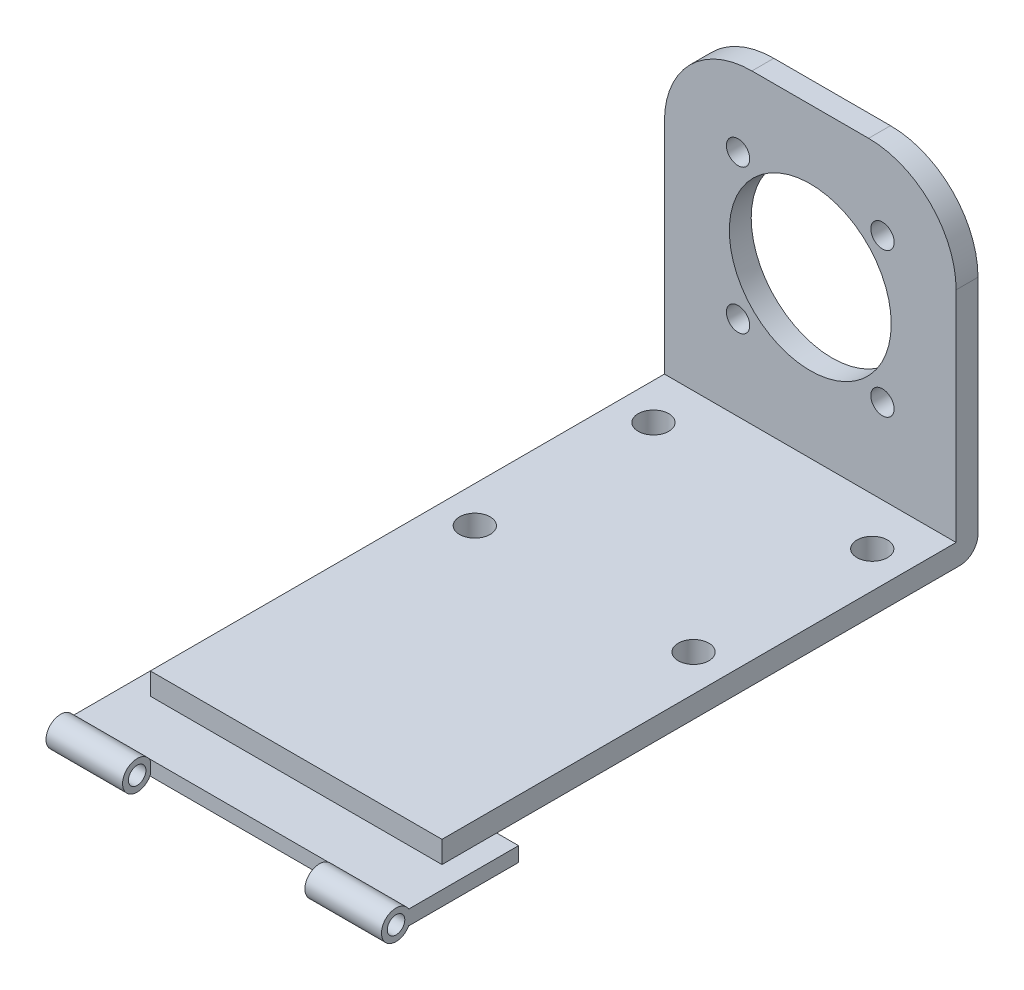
SolidWorks part; units mm, degrees
ref_plane "Front Plane" through (0, 0, 0) normal (0, 0, 1) x (1, 0, 0)
ref_plane "Top Plane" through (0, 0, 0) normal (0, 1, 0) x (1, 0, 0)
ref_plane "Right Plane" through (0, 0, 0) normal (1, 0, 0) x (0, 0, -1)
sketch "Sketch1" plane through (0, 0, 0) normal (1, 0, 0) x (0, 0, -1)
  line L0 (23.1464, 33.4195) -> (23.1464, -8.5805)
  line L1 (23.1464, -8.5805) -> (-15.3536, -8.5805)
  line L2 (-15.3536, -8.5805) -> (-15.3536, -11.5805)
  line L3 (-15.3536, -11.5805) -> (23.6464, -11.5805)
  line L4 (26.1464, -9.0805) -> (26.1464, 33.4195)
  line L5 (26.1464, 33.4195) -> (23.1464, 33.4195)
  arc A0 (23.6464, -11.5805) -> (26.1464, -9.0805) centre (23.6464, -9.0805) ccw
  point P8 (26.1464, -11.5805)
  dimension "D5" = 2.5
  dimension "D1" = 41.5
  dimension "D2" = 45
  dimension "D3" = 3
  dimension "D4" = 3
extrude "Boss-Extrude1" add sketch "Sketch1" against normal blind 40
sketch "Sketch2" plane through (0, 0, -23.1464) normal (0, 0, 1) x (1, 0, 0)
  line L0 (-40, 33.4195) -> (0, 33.4195) construction
  line L1 (-31.1, 12.9195) -> (-8.9, 12.9195)
  circle A1 centre (-20, 12.9195) radius 11.1
  circle A2 centre (-10.1005, 22.819) radius 1.6
  circle A4 centre (-29.8995, 3.02) radius 1.6
  circle A5 centre (-29.8995, 22.819) radius 1.6
  circle A6 centre (-10.1005, 3.02) radius 1.6
  point P0 (-20, 12.9195)
  dimension "D3" = 22.2
  dimension "D4" = 3.2
  dimension "D5" = 3.2
  dimension "D6" = 3.2
  dimension "D7" = 3.2
  dimension "D1" = 20.5
extrude "Cut-Extrude1" cut sketch "Sketch2" against normal blind 40 contours A1 | A4 | A6 | A2 | A5
sketch "Sketch3" plane through (0, 0, -23.1464) normal (0, 0, 1) x (1, 0, 0)
  line L1 (0, 21.4195) -> (0, 33.4195)
  line L3 (0, 33.4195) -> (-12, 33.4195)
  line L5 (-28, 33.4195) -> (-40, 33.4195)
  line L6 (-40, 33.4195) -> (-40, 21.4195)
  arc A0 (-12, 33.4195) -> (0, 21.4195) centre (-12, 21.4195) cw
  arc A1 (-28, 33.4195) -> (-40, 21.4195) centre (-28, 21.4195) ccw
  dimension "D1" = 12
extrude "Cut-Extrude2" cut sketch "Sketch3" against normal blind 40
sketch "Sketch4" plane through (0, -8.5805, 0) normal (0, 1, 0) x (1, 0, 0)
  line L0 (-40, -15.3536) -> (0, -15.3536) construction
  line L1 (-5, -7.8536) -> (-35, -7.8536)
  line L2 (-5, -7.8536) -> (-5, 16.6464)
  line L3 (-5, 16.6464) -> (-35, 16.6464)
  line L4 (-35, -7.8536) -> (-35, 16.6464)
  line L5 (-5, -7.8536) -> (-35, 16.6464) construction
  line L6 (-5, 16.6464) -> (-35, -7.8536) construction
  line L8 (0, 23.1464) -> (0, -15.3536) construction
  circle A0 centre (-5, -7.8536) radius 2.1
  circle A1 centre (-35, -7.8536) radius 2.1
  circle A2 centre (-35, 16.6464) radius 2.1
  circle A3 centre (-5, 16.6464) radius 2.1
  point P0 (-20, 4.3964)
  dimension "D4" = 4.2
  dimension "D5" = 4.2
  dimension "D6" = 4.2
  dimension "D7" = 4.2
  dimension "D1" = 30
  dimension "D2" = 24.5
  dimension "D3" = 7.5
  dimension "D8" = 5
extrude "Cut-Extrude3" cut sketch "Sketch4" against normal blind 40 contours A1 | A2 | A0 | A3
sketch "Sketch5" plane through (-40, 0, 0) normal (-1, 0, 0) x (0, 0, 1)
  line L1 (15.3536, -8.5805) -> (47.3536, -8.5805)
  line L2 (15.3536, -8.5805) -> (15.3536, -11.5805)
  line L3 (15.3536, -11.5805) -> (47.3536, -11.5805)
  line L4 (47.3536, -8.5805) -> (47.3536, -11.5805)
  dimension "D1" = 32
extrude "Boss-Extrude2" add sketch "Sketch5" against normal up to surface (40 mm away)
sketch "Sketch6" plane through (0, -11.5805, 0) normal (0, -1, 0) x (1, 0, 0)
  line L0 (0, 47.3536) -> (-40, 47.3536) construction
  line L1 (-45, 54.8536) -> (5, 54.8536)
  line L2 (-45, 54.8536) -> (-45, 39.8536)
  line L3 (-45, 39.8536) -> (5, 39.8536)
  line L4 (5, 54.8536) -> (5, 39.8536)
  line L5 (-45, 54.8536) -> (5, 39.8536) construction
  line L6 (-45, 39.8536) -> (5, 54.8536) construction
  point P0 (-20, 47.3536)
  dimension "D1" = 50
  dimension "D2" = 15
extrude "Boss-Extrude3" add sketch "Sketch6" along normal blind 2
sketch "Sketch8" plane through (-45, 0, 0) normal (-1, 0, 0) x (0, 0, 1)
  line L0 (54.8536, -13.5805) -> (54.8536, -11.5805) construction
  circle A0 centre (56.6536, -12.5805) radius 2
  circle A1 centre (56.6536, -12.5805) radius 1.2
  dimension "D1" = 4
  dimension "D3" = 2.4
  dimension "D2" = 1.8
extrude "Boss-Extrude4" add sketch "Sketch8" along normal blind 12.5 and the other way blind 12.5
sketch "Sketch9" plane through (5, 0, 0) normal (1, 0, 0) x (0, 0, -1)
  circle A1 centre (-56.6536, -12.5805) radius 1.2
  circle A2 centre (-56.6536, -12.5805) radius 1.2
  circle A3 centre (-56.6536, -12.5805) radius 2
  circle A4 centre (-56.6536, -12.5805) radius 2
  dimension "D1" = 0
  dimension "D2" = 0
extrude "Boss-Extrude5" add sketch "Sketch9" along normal blind 12.5 and the other way blind 12.5
sketch "Sketch10" plane through (0, -11.5805, 0) normal (0, 1, 0) x (1, 0, 0)
  line L0 (7.0946, -36.2979) -> (3, -36.2979)
  line L1 (3, -36.2979) -> (3, -66.3037)
  line L2 (3, -66.3037) -> (7.0946, -66.3037)
  line L3 (7.0946, -66.3037) -> (21.0602, -66.3037)
  line L4 (21.0602, -66.3037) -> (21.0602, -36.2979)
  line L5 (21.0602, -36.2979) -> (7.0946, -36.2979)
  line L6 (-43, -36.2979) -> (-43, -66.3037)
  line L7 (-43, -66.3037) -> (-58.7231, -66.3037)
  line L8 (-58.7231, -66.3037) -> (-58.7231, -36.2979)
  line L9 (-58.7231, -36.2979) -> (-43, -36.2979)
  line L10 (-45, -54.8536) -> (-45, -39.8536) construction
  line L11 (5, -39.8536) -> (5, -54.8536) construction
  dimension "D1" = 2
  dimension "D2" = 2
extrude "Cut-Extrude4" cut sketch "Sketch10" against normal blind 10 and the other way blind 10
